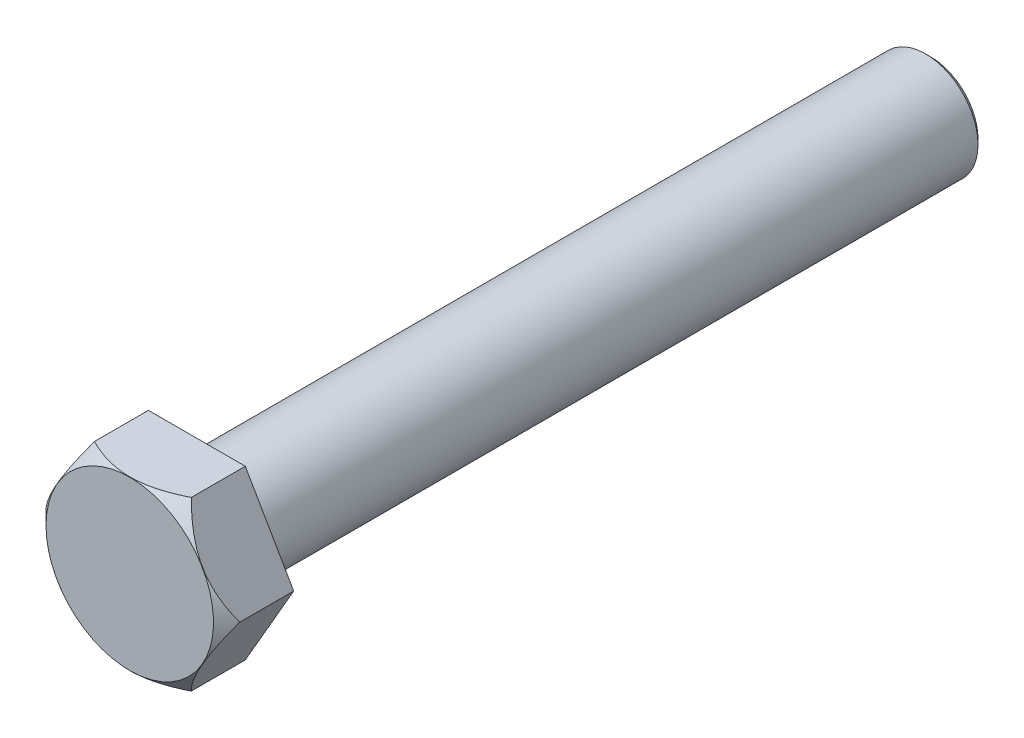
SolidWorks part; units mm, degrees
ref_plane "Plan de face" through (0, 0, 0) normal (0, 0, 1) x (1, 0, 0)
ref_plane "Plan de dessus" through (0, 0, 0) normal (0, 1, 0) x (1, 0, 0)
ref_plane "Plan de droite" through (0, 0, 0) normal (1, 0, 0) x (0, 0, -1)
sketch "Esquisse1" plane through (0, 0, 0) normal (0, 0, 1) x (1, 0, 0)
  line L1 (9.2376, 0) -> (4.6188, 8)
  line L2 (4.6188, 8) -> (-4.6188, 8)
  line L3 (-4.6188, 8) -> (-9.2376, 0)
  line L4 (-9.2376, 0) -> (-4.6188, -8)
  line L5 (-4.6188, -8) -> (4.6188, -8)
  line L6 (4.6188, -8) -> (9.2376, 0)
  circle A0 centre (0, 0) radius 8 construction
  dimension "D1" = 16
extrude "Boss.-Extru.1" add sketch "Esquisse1" along normal blind 6.4
sketch "Esquisse3" plane through (0, 0, 0) normal (0, 1, 0) x (1, 0, 0)
  line L0 (0, 2.9031) -> (0, -10.4428) construction
  line L1 (-9.2376, -5.15) -> (-7.9876, -6.4)
  line L2 (-10.1543, -8.0782) -> (-7.9876, -8.0782)
  line L3 (-10.1543, -8.0782) -> (-10.1543, -5.15)
  line L4 (-10.1543, -5.15) -> (-9.2376, -5.15)
  line L5 (-7.9876, -8.0782) -> (-7.9876, -6.4)
  line L6 (-9.2376, -6.4) -> (-9.2376, 0) construction
  line L8 (-4.6188, -6.4) -> (-9.2376, -6.4) construction
  dimension "D1" = 1.25
  dimension "D2" = 1.25
revolve "Enlèvement de matière-Révolution2" cut sketch "Esquisse3" angle 360 about L0
sketch "Esquisse4" plane through (0, 0, 0) normal (1, 0, 0) x (0, 0, -1)
  line L0 (0, 0) -> (83.8832, 0) construction
  line L1 (0, -5) -> (69.5, -5)
  line L2 (0, -8) -> (0, 0) construction
  line L3 (70, -4.5) -> (70, 0)
  line L4 (69.5, -5) -> (70, -4.5)
  line L5 (0, -5) -> (0, 0)
  line L6 (0, 0) -> (70, 0)
  point P4 (70, -5)
  dimension "D1" = 5
  dimension "D2" = 70
  dimension "D6" = 0.5
revolve "Révolution2" add sketch "Esquisse4" angle 360 about L0
